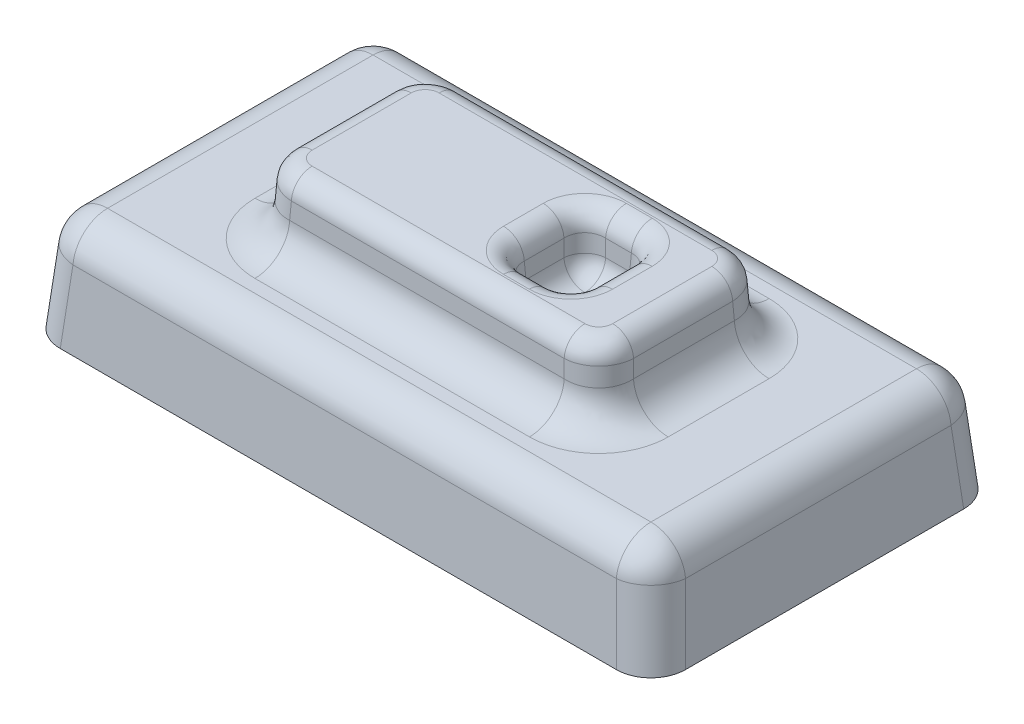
SolidWorks part; units mm, degrees
ref_plane "正面" through (0, 0, 0) normal (0, 0, 1) x (1, 0, 0)
ref_plane "平面" through (0, 0, 0) normal (0, 1, 0) x (1, 0, 0)
ref_plane "右側面" through (0, 0, 0) normal (1, 0, 0) x (0, 0, -1)
sketch "ｽｹｯﾁ1" plane through (0, 0, 0) normal (0, 1, 0) x (1, 0, 0)
  line L1 (90, -50) -> (-90, -50)
  line L2 (90, -50) -> (90, 50)
  line L3 (90, 50) -> (-90, 50)
  line L4 (-90, -50) -> (-90, 50)
  line L5 (90, -50) -> (-90, 50) construction
  line L6 (90, 50) -> (-90, -50) construction
  point P0 (0, 0)
  dimension "D1" = 180
  dimension "D2" = 100
extrude "押し出し1" add sketch "ｽｹｯﾁ1" along normal blind 30 draft 5
sketch "ｽｹｯﾁ2" plane through (0, 30, 0) normal (0, 1, 0) x (1, 0, 0)
  line L1 (-50, 25) -> (50, 25)
  line L2 (-50, 25) -> (-50, -25)
  line L3 (-50, -25) -> (50, -25)
  line L4 (50, 25) -> (50, -25)
  line L5 (-50, 25) -> (50, -25) construction
  line L6 (-50, -25) -> (50, 25) construction
  point P0 (0, 0)
  dimension "D1" = 100
  dimension "D2" = 50
extrude "押し出し2" add sketch "ｽｹｯﾁ2" along normal blind 20 draft 3
sketch "ｽｹｯﾁ3" plane through (0, 50, 0) normal (0, 1, 0) x (1, 0, 0)
  line L0 (48.9518, -23.9518) -> (48.9518, 23.9518) construction
  line L1 (8.9518, 12) -> (28.9518, 12)
  line L2 (8.9518, 12) -> (8.9518, -12)
  line L3 (8.9518, -12) -> (28.9518, -12)
  line L4 (28.9518, 12) -> (28.9518, -12)
  point P7 (8.9518, 0)
  dimension "D1" = 20
  dimension "D2" = 24
  dimension "D3" = 20
extrude "押し出し3" cut sketch "ｽｹｯﾁ3" against normal blind 16 draft 3
fillet "ﾌｨﾚｯﾄ1" radius 10 16 edges at (-50, 30, 0) (0, 30, 25) (50, 30, 0) (0, 30, -25) (0, 30, -47.3753) (87.3753, 30, 0) (0, 30, 47.3753) (-87.3753, 30, 0) (-49.4759, 40, -24.4759) (-49.4759, 40, 24.4759) (49.4759, 40, -24.4759) (49.4759, 40, 24.4759) (-88.6877, 15, -48.6877) (-88.6877, 15, 48.6877) (88.6877, 15, -48.6877) (88.6877, 15, 48.6877)
fillet "ﾌｨﾚｯﾄ2" radius 6 20 edges at (18.9518, 34, -11.1615) (28.1133, 34, 0) (18.9518, 34, 11.1615) (9.7904, 34, 0) (46.0286, 50, -21.0286) (48.9518, 50, 0) (46.0286, 50, 21.0286) (0, 50, 23.9518) (-46.0286, 50, 21.0286) (-48.9518, 50, 0) (-46.0286, 50, -21.0286) (0, 50, -23.9518) (18.9518, 50, 12) (28.9518, 50, 0) (18.9518, 50, -12) (8.9518, 50, 0) (9.3711, 42, 11.5807) (28.5326, 42, 11.5807) (28.5326, 42, -11.5807) (9.3711, 42, -11.5807)
